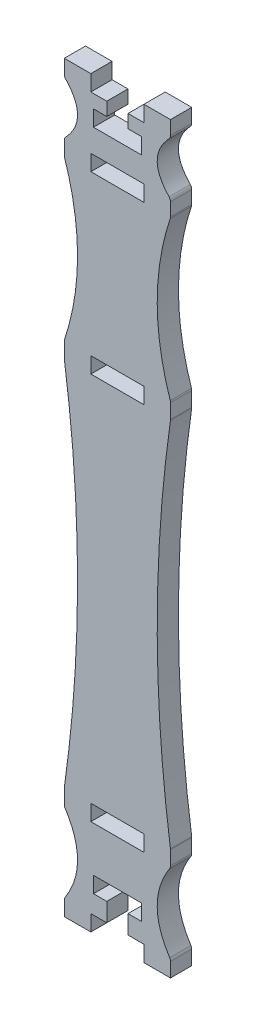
SolidWorks part; units mm, degrees
ref_plane "Alzado" through (0, 0, 0) normal (0, 0, 1) x (1, 0, 0)
ref_plane "Planta" through (0, 0, 0) normal (0, 1, 0) x (1, 0, 0)
ref_plane "Vista lateral" through (0, 0, 0) normal (1, 0, 0) x (0, 0, -1)
sketch "Croquis1" plane through (0, 0, 0) normal (0, 0, 1) x (1, 0, 0)
  line L0 (-15, -70) -> (-10, -70)
  line L1 (-10, 70) -> (-10, 67)
  line L2 (-7, 67) -> (-10, 67)
  line L3 (0, -70) -> (5, -70)
  line L4 (-15, 67.4057) -> (-15, 70)
  line L5 (0, -70) -> (0, -67)
  line L6 (-7, -63.5) -> (-7, -67)
  line L7 (-0.5, -60.5) -> (-9.5, -60.5)
  line L8 (-10, -67) -> (-10, -70)
  line L9 (-10, 70) -> (-15, 70)
  line L10 (-9.5, 61.5) -> (-0.5, 61.5)
  line L11 (-10, -52) -> (-10, -49)
  line L12 (-10, -52) -> (0, -52)
  line L13 (-0.5, -60.5) -> (-0.5, -63.5)
  line L14 (-0.5, -63.5) -> (-3, -63.5)
  line L15 (-10, -49) -> (0, -49)
  line L16 (0, -49) -> (0, -52)
  line L17 (-0.5, 61.5) -> (-0.5, 64.5)
  line L18 (-3, -63.5) -> (-3, -67)
  line L19 (-0.5, 64.5) -> (-3, 64.5)
  line L20 (-10, 21) -> (0, 21)
  line L21 (-3, 64.5) -> (-3, 67)
  line L22 (-10, 21) -> (-10, 24)
  line L23 (-10, 24) -> (0, 24)
  line L24 (-7, 64.5) -> (-7, 67)
  line L25 (0, 24) -> (0, 21)
  line L26 (-9.5, -63.5) -> (-7, -63.5)
  line L27 (-9.5, -60.5) -> (-9.5, -63.5)
  line L28 (-7, -67) -> (-10, -67)
  line L29 (-9.5, 64.5) -> (-7, 64.5)
  line L30 (-9.5, 61.5) -> (-9.5, 64.5)
  line L31 (-10, 54) -> (-10, 57)
  line L32 (-10, 54) -> (0, 54)
  line L33 (-10, 57) -> (0, 57)
  line L34 (0, 57) -> (0, 54)
  line L35 (-3, 67) -> (0, 67)
  line L36 (5, 67.4057) -> (5, 70)
  line L37 (0, 67) -> (0, 70)
  line L38 (5, 70) -> (0, 70)
  line L43 (0, -67) -> (-3, -67)
  line L46 (5, 56.5943) -> (5, 54.1615)
  line L49 (-15, 54.1615) -> (-15, 56.5943)
  line L52 (5, 23.8385) -> (5, 21.071)
  line L56 (-15, 23.8385) -> (-15, 21.071)
  line L62 (-15, -49.071) -> (-15, -51.7014)
  line L65 (-15, -67.2986) -> (-15, -70)
  line L67 (5, -70) -> (5, -67.2986)
  line L70 (5, -51.7014) -> (5, -49.071)
  arc A0 (5, -67.2986) -> (4.8403, -66.7566) centre (4, -67.2986) ccw
  arc A1 (-14.8403, -66.7566) -> (-15, -67.2986) centre (-14, -67.2986) ccw
  arc A2 (-14.99, -48.9299) -> (-15, -49.071) centre (-14, -49.071) ccw
  arc A3 (-15, -51.7014) -> (-14.8403, -52.2434) centre (-14, -51.7014) ccw
  arc A4 (4.8403, -52.2434) -> (5, -51.7014) centre (4, -51.7014) ccw
  arc A5 (5, -49.071) -> (4.99, -48.9299) centre (4, -49.071) ccw
  arc A6 (-15, 21.071) -> (-14.99, 20.9299) centre (-14, 21.071) ccw
  arc A7 (5, 21.071) -> (4.99, 20.9299) centre (4, 21.071) cw
  arc A8 (4.9496, 24.1518) -> (5, 23.8385) centre (4, 23.8385) cw
  arc A9 (-15, 23.8385) -> (-14.9496, 24.1518) centre (-14, 23.8385) cw
  arc A10 (5, 54.1615) -> (4.9496, 53.8482) centre (4, 54.1615) cw
  arc A11 (-14.9496, 53.8482) -> (-15, 54.1615) centre (-14, 54.1615) cw
  arc A12 (-15, 56.5943) -> (-14.7272, 57.2807) centre (-14, 56.5943) cw
  arc A13 (4.7272, 57.2807) -> (5, 56.5943) centre (4, 56.5943) cw
  arc A14 (4.7272, 66.7193) -> (5, 67.4057) centre (4, 67.4057) ccw
  arc A15 (-14.7272, 66.7193) -> (-15, 67.4057) centre (-14, 67.4057) cw
  spline S0 degree 3 poles (-14.8403, -66.7566) (-13.2801, -64.3377) (-11.7199, -59.5) (-13.2801, -54.6623) (-14.8403, -52.2434) knots 0.016229 0.016229 0.016229 0.016229 0.5 0.983771 0.983771 0.983771 0.983771
  spline S1 degree 3 poles (4.8403, -66.7566) (3.2801, -64.3377) (1.7199, -59.5) (3.2801, -54.6623) (4.8403, -52.2434) knots 0.016229 0.016229 0.016229 0.016229 0.5 0.983771 0.983771 0.983771 0.983771
  spline S2 degree 3 poles (4.99, -48.9299) (3.33, -37.2866) (1.67, -14) (3.33, 9.2866) (4.99, 20.9299) knots 0.001002 0.001002 0.001002 0.001002 0.5 0.998998 0.998998 0.998998 0.998998
  spline S3 degree 3 poles (-14.99, -48.9299) (-13.33, -37.2866) (-11.67, -14) (-13.33, 9.2866) (-14.99, 20.9299) knots 0.001002 0.001002 0.001002 0.001002 0.5 0.998998 0.998998 0.998998 0.998998
  spline S4 degree 3 poles (4.9496, 24.1518) (3.3165, 29.1012) (1.6835, 39) (3.3165, 48.8988) (4.9496, 53.8482) knots 0.005062 0.005062 0.005062 0.005062 0.5 0.994938 0.994938 0.994938 0.994938
  spline S5 degree 3 poles (-14.9496, 24.1518) (-13.3165, 29.1012) (-11.6835, 39) (-13.3165, 48.8988) (-14.9496, 53.8482) knots 0.005062 0.005062 0.005062 0.005062 0.5 0.994938 0.994938 0.994938 0.994938
  spline S6 degree 3 poles (-14.7272, 57.2807) (-13.2424, 58.8538) (-11.7576, 62) (-13.2424, 65.1462) (-14.7272, 66.7193) knots 0.028065 0.028065 0.028065 0.028065 0.5 0.971935 0.971935 0.971935 0.971935
  spline S7 degree 3 poles (4.7272, 57.2807) (3.2424, 58.8538) (1.7576, 62) (3.2424, 65.1462) (4.7272, 66.7193) knots 0.028065 0.028065 0.028065 0.028065 0.5 0.971935 0.971935 0.971935 0.971935
  point P7 (-15, 0)
  dimension "D1" = 1
extrude "Saliente-Extruir1" add sketch "Croquis1" along normal blind 4
